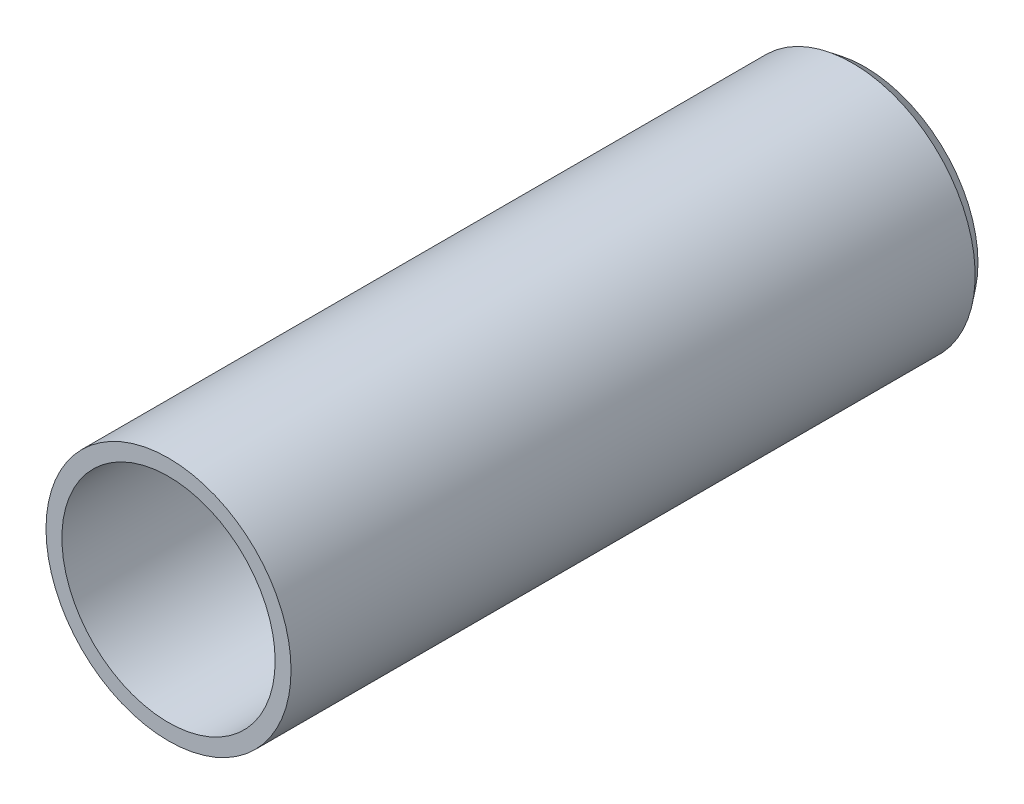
SolidWorks part; units mm, degrees
ref_plane "Front" through (0, 0, 0) normal (0, 0, 1) x (1, 0, 0)
ref_plane "Top" through (0, 0, 0) normal (0, 1, 0) x (1, 0, 0)
ref_plane "Right" through (0, 0, 0) normal (1, 0, 0) x (0, 0, -1)
sketch "Sketch1" plane through (0, 0, 0) normal (0, 0, 1) x (1, 0, 0)
  circle A0 centre (0, 0) radius 30.1625
  circle A1 centre (0, 0) radius 26.2509
  dimension "D1" = 60.325
  dimension "D2" = 3.9116
extrude "Extrude1" add sketch "Sketch1" along normal blind 171.45
sketch "Sketch5" plane through (0, 0, 0) normal (1, 0, 0) x (0, 0, -1)
  line L0 (5.2903, 0) -> (-155.3428, 0) construction
  line L1 (-3.0288, -30.1625) -> (0, -27.8384)
  line L4 (-171.45, -30.1625) -> (0, -30.1625) construction
  line L5 (0, -30.1625) -> (0, 30.1625) construction
  line L6 (0, -27.8384) -> (0, -30.1625)
  line L7 (0, -30.1625) -> (-3.0288, -30.1625)
  dimension "D1" = 1.5875
  dimension "D2" = 37.5
revolve "Cut-Revolve1" cut sketch "Sketch5" angle 360 about L0
